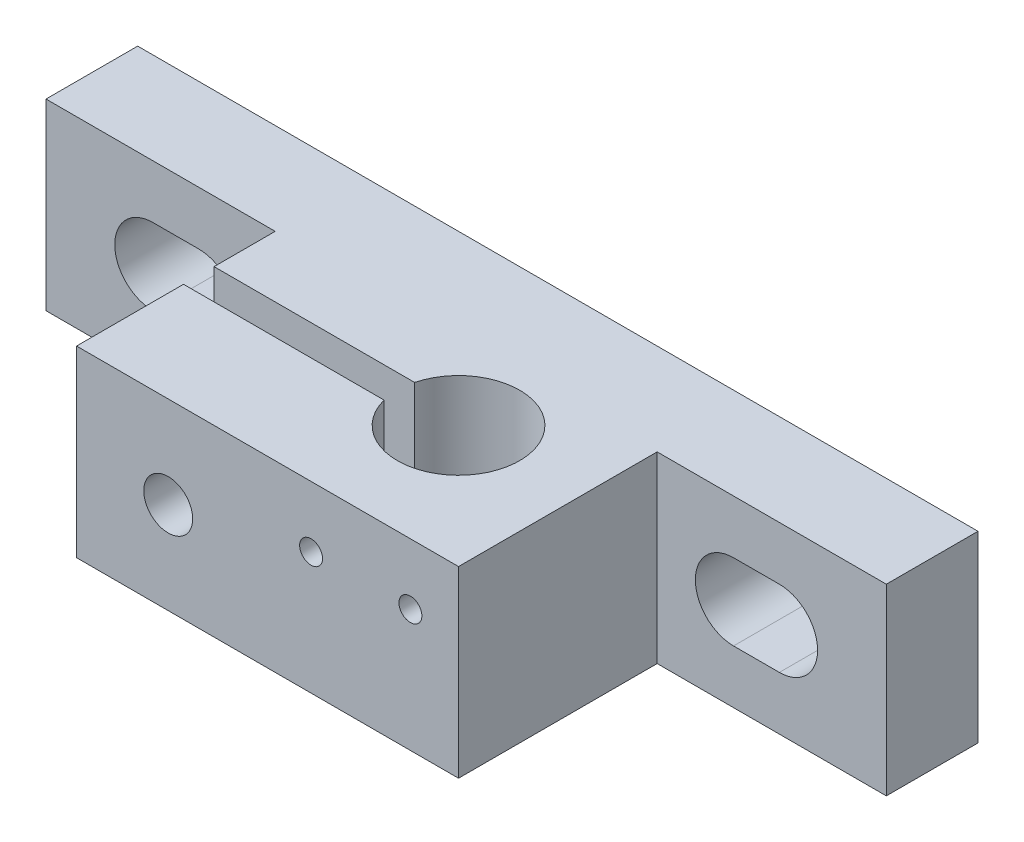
SolidWorks part; units mm, degrees
ref_plane "Front Plane" through (0, 0, 0) normal (0, 0, 1) x (1, 0, 0)
ref_plane "Top Plane" through (0, 0, 0) normal (0, 1, 0) x (1, 0, 0)
ref_plane "Right Plane" through (0, 0, 0) normal (1, 0, 0) x (0, 0, -1)
sketch "Sketch2" plane through (0, 0, 0) normal (0, 0, 1) x (1, 0, 0)
  line L0 (7, 6) -> (10, 6) construction
  line L1 (0, 0) -> (55, 0)
  line L2 (0, 0) -> (0, 12)
  line L3 (0, 12) -> (55, 12)
  line L4 (55, 0) -> (55, 12)
  line L5 (27.5, 12) -> (27.5, -3.75) construction
  line L6 (7, 8.5) -> (10, 8.5)
  line L7 (7, 3.5) -> (10, 3.5)
  line L8 (48, 6) -> (45, 6) construction
  line L9 (48, 8.5) -> (45, 8.5)
  line L10 (48, 3.5) -> (45, 3.5)
  arc A0 (7, 8.5) -> (7, 3.5) centre (7, 6) ccw
  arc A1 (48, 8.5) -> (48, 3.5) centre (48, 6) cw
  arc A2 (10, 3.5) -> (10, 8.5) centre (10, 6) ccw
  arc A3 (45, 3.5) -> (45, 8.5) centre (45, 6) cw
  point P11 (8.5, 6)
  point P16 (46.5, 6)
  dimension "D1" = 7
  dimension "D2" = 3
  dimension "D5" = 55
extrude "Boss-Extrude1" add sketch "Sketch2" along normal blind 6
sketch "Sketch3" plane through (0, 0, 6) normal (0, 0, 1) x (1, 0, 0)
  line L0 (0, 0) -> (55, 0) construction
  line L1 (15, 0) -> (40, 0)
  line L2 (15, 0) -> (15, 12)
  line L3 (15, 12) -> (40, 12)
  line L4 (40, 0) -> (40, 12)
  line L5 (55, 12) -> (0, 12) construction
  line L6 (0, 12) -> (0, 0) construction
  line L7 (55, 0) -> (55, 12) construction
  dimension "D1" = 25
  dimension "D2" = 15
  dimension "D3" = 15
extrude "Boss-Extrude2" add sketch "Sketch3" along normal blind 13
sketch "Sketch4" plane through (0, 0, 0) normal (0, -1, 0) x (1, 0, 0)
  line L0 (15, 19) -> (40, 19) construction
  line L1 (40, 19) -> (40, 6) construction
  line L2 (0, 0) -> (55, 0) construction
  line L3 (28.127, 12) -> (15, 12)
  line L4 (15, 19) -> (15, 6) construction
  line L5 (15, 12) -> (15, 10)
  line L6 (15, 10) -> (28.127, 10)
  circle A0 centre (32, 11) radius 4
  dimension "D1" = 8
  dimension "D5" = 8
  dimension "D7" = 11
  dimension "D2" = 8
  dimension "D3" = 11
  dimension "D4" = 1
  dimension "D6" = 1
extrude "Cut-Extrude2" cut sketch "Sketch4" against normal blind 30 contours A0 L3 L6 M4 | A0
sketch "Sketch5" plane through (0, 0, 0) normal (0, 0, -1) x (-1, 0, 0)
  line L0 (-55, 12) -> (0, 12) construction
  line L1 (-37.6724, 9.5) -> (-17.1585, 9.5)
  line L2 (-37.6724, 9.5) -> (-37.6724, 2.5)
  line L3 (-37.6724, 2.5) -> (-17.1585, 2.5)
  line L4 (-17.1585, 9.5) -> (-17.1585, 2.5)
  line L5 (0, 0) -> (-55, 0) construction
  line L6 (0, 12) -> (0, 0) construction
  dimension "D1" = 20.5139
  dimension "D2" = 2.5
  dimension "D3" = 2.5
  dimension "D4" = 17.1585
extrude "Cut-Extrude3" cut sketch "Sketch5" against normal blind 5
sketch "Sketch6" plane through (0, 0, 19) normal (0, 0, 1) x (1, 0, 0)
  line L0 (15, 12) -> (15, 0) construction
  line L1 (40, 12) -> (15, 12) construction
  line L2 (15, 0) -> (40, 0) construction
  circle A0 centre (21, 6) radius 1.6
  dimension "D1" = 6
  dimension "D2" = 6
  dimension "D3" = 6
extrude "Cut-Extrude4" cut sketch "Sketch6" against normal blind 20
sketch "Sketch7" plane through (0, 0, 5) normal (0, 0, -1) x (-1, 0, 0)
  line L1 (-17.5359, 6) -> (-19.2679, 9)
  line L2 (-19.2679, 9) -> (-22.7321, 9)
  line L3 (-22.7321, 9) -> (-24.4641, 6)
  line L4 (-24.4641, 6) -> (-22.7321, 3)
  line L5 (-22.7321, 3) -> (-19.2679, 3)
  line L6 (-19.2679, 3) -> (-17.5359, 6)
  circle A0 centre (-21, 6) radius 3 construction
extrude "Cut-Extrude5" cut sketch "Sketch7" against normal blind 3
sketch "Sketch8" plane through (0, 0, 19) normal (0, 0, 1) x (1, 0, 0)
  line L0 (40, 0) -> (40, 12) construction
  line L1 (40, 12) -> (15, 12) construction
  circle A0 centre (36.85, 8) radius 0.75
  circle A1 centre (30.35, 8) radius 0.75
  dimension "D1" = 1.5
  dimension "D2" = 3.15
  dimension "D3" = 4
  dimension "D4" = 2
extrude "Cut-Extrude6" cut sketch "Sketch8" against normal blind 3
